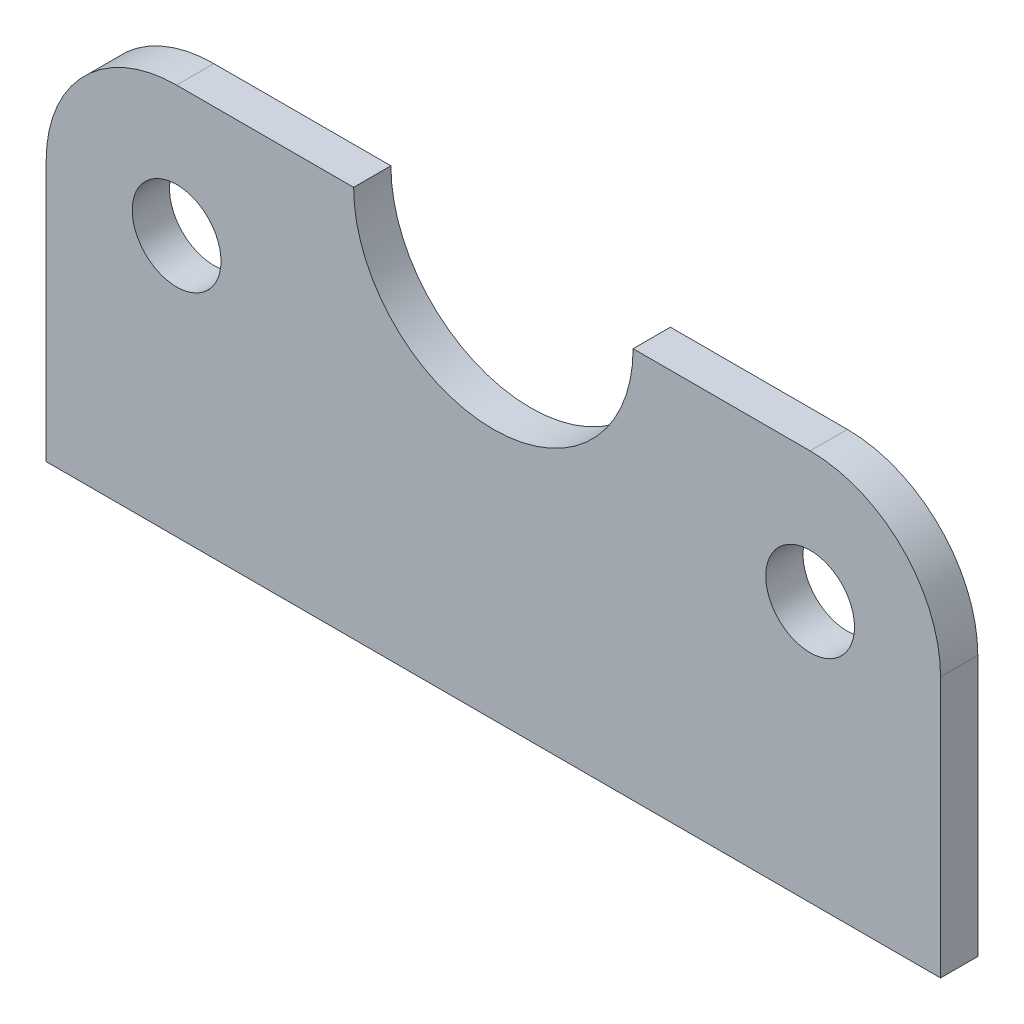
SolidWorks part; units mm, degrees
ref_plane "Front" through (0, 0, 0) normal (0, 0, 1) x (1, 0, 0)
ref_plane "Top" through (0, 0, 0) normal (0, 1, 0) x (1, 0, 0)
ref_plane "Right" through (0, 0, 0) normal (1, 0, 0) x (0, 0, -1)
sketch "Sketch2" plane through (0, 0, 0) normal (0, 0, 1) x (1, 0, 0)
  line L10 (0, 0) -> (0, 29.6333)
  line L11 (-14.8167, 44.45) -> (-34.925, 44.45)
  line L12 (-66.675, 44.45) -> (-86.7833, 44.45)
  line L13 (-101.6, 29.6333) -> (-101.6, 0)
  line L14 (-101.6, 0) -> (0, 0)
  arc A6 (0, 29.6333) -> (-14.8167, 44.45) centre (-14.8167, 29.6333) ccw
  arc A7 (-66.675, 44.45) -> (-34.925, 44.45) centre (-50.8, 44.45) ccw
  arc A8 (-86.7833, 44.45) -> (-101.6, 29.6333) centre (-86.7833, 29.6333) ccw
  dimension "D3" = 15.875
  dimension "D4" = 14.8167
  dimension "D1" = 101.6
  dimension "D2" = 44.45
extrude "Base-Extrude" add sketch "Sketch2" against normal blind 4.2333
hole_wizard "3/8 Clearance Hole1" positions "Sketch6" profile "Sketch5" hole size "3/8" standard "Ansi Inch"
sketch "Sketch6" plane through (0, 0, 0) normal (0, 0, 1) x (1, 0, 0)
  arc A0 (-86.7833, 44.45) -> (-101.6, 29.6333) centre (-86.7833, 29.6333) ccw construction
  point P0 (-86.7833, 29.6333)
  point P1 (-14.8167, 29.6333)
sketch "Sketch5" plane through (-86.7833, 29.6333, 0) normal (1, 0, 0) x (0, -1, 0)
  line L0 (0, 0) -> (0, 22.0795)
  line L1 (0, 22.0795) -> (5.0419, 19.05)
  line L2 (5.0419, 19.05) -> (5.0419, 0)
  line L5 (5.0419, 0) -> (0, 0)
  line L10 (0, 22.0795) -> (-5.0419, 19.05) construction
  line L11 (0, -6.35) -> (0, 107.95) construction
  dimension "Hole Dia." = 10.0838
  dimension "Hole Depth" = 19.05
  dimension "Drill Angle" = 118
